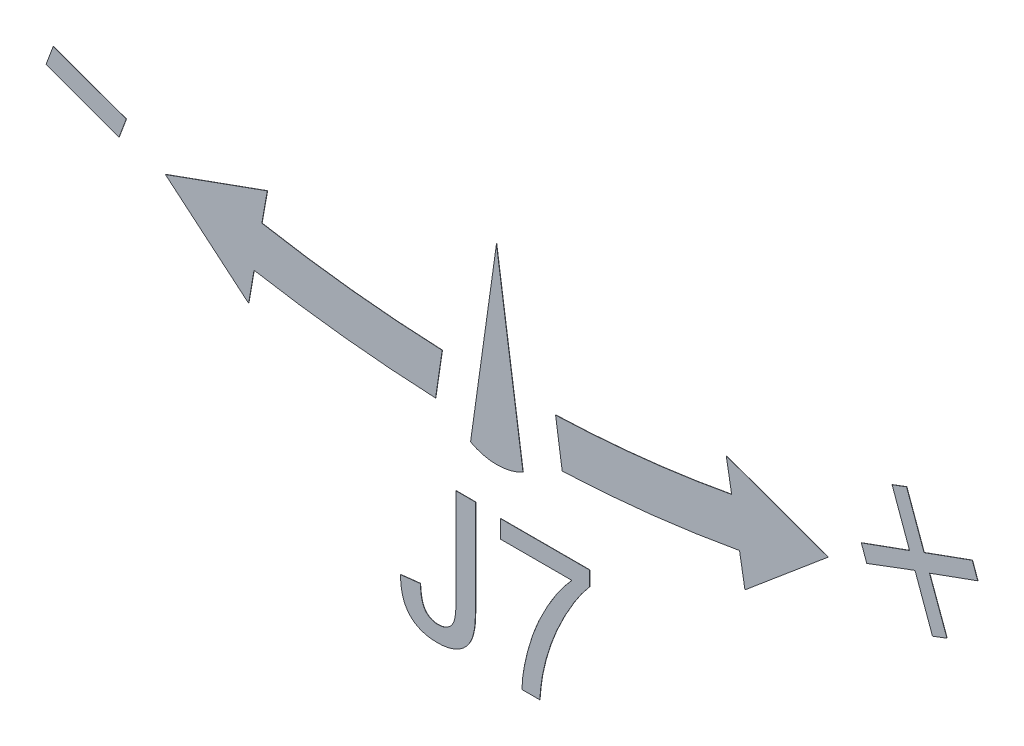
SolidWorks part; units mm, degrees
ref_plane "Front" through (0, 0, 0) normal (0, 0, 1) x (1, 0, 0)
ref_plane "Top" through (0, 0, 0) normal (0, 1, 0) x (1, 0, 0)
ref_plane "Right" through (0, 0, 0) normal (1, 0, 0) x (0, 0, -1)
sketch "Sketch1" plane through (0, 0, 0) normal (0, 0, 1) x (1, 0, 0)
  line L1616 (4481.7115, 1822.0394) -> (4481.7115, 1905.9102)
  line L1617 (4447.8406, 1780.6416) -> (4455.9051, 1781.1792)
  line L1618 (4455.9051, 1781.1792) -> (4464.5072, 1783.8674)
  line L1619 (4464.5072, 1783.8674) -> (4471.4964, 1788.7061)
  line L1620 (4471.4964, 1788.7061) -> (4476.8728, 1795.6953)
  line L1621 (4476.8728, 1795.6953) -> (4480.0986, 1803.7598)
  line L1622 (4480.0986, 1803.7598) -> (4481.1738, 1812.8996)
  line L1623 (4481.1738, 1812.8996) -> (4481.7115, 1822.0394)
  line L1624 (4415.0449, 1816.663) -> (4415.5826, 1809.1362)
  line L1625 (4415.5826, 1809.1362) -> (4416.6578, 1801.0717)
  line L1626 (4416.6578, 1801.0717) -> (4419.8836, 1794.0824)
  line L1627 (4419.8836, 1794.0824) -> (4424.7223, 1788.1685)
  line L1628 (4424.7223, 1788.1685) -> (4431.7116, 1783.8674)
  line L1629 (4431.7116, 1783.8674) -> (4439.2384, 1781.1792)
  line L1630 (4439.2384, 1781.1792) -> (4447.8406, 1780.6416)
  line L1631 (4432.2492, 1818.8136) -> (4415.0449, 1816.663)
  line L1632 (4448.3782, 1794.6201) -> (4444.0771, 1795.1577)
  line L1633 (4444.0771, 1795.1577) -> (4440.3137, 1796.7706)
  line L1634 (4440.3137, 1796.7706) -> (4437.6255, 1799.4588)
  line L1635 (4437.6255, 1799.4588) -> (4435.475, 1802.6846)
  line L1636 (4435.475, 1802.6846) -> (4433.3245, 1810.7491)
  line L1637 (4433.3245, 1810.7491) -> (4432.2492, 1818.8136)
  line L1638 (4463.9696, 1820.9641) -> (4463.9696, 1815.0501)
  line L1639 (4463.9696, 1815.0501) -> (4463.4319, 1809.1362)
  line L1640 (4463.4319, 1809.1362) -> (4462.3567, 1803.7598)
  line L1641 (4462.3567, 1803.7598) -> (4459.6685, 1799.9964)
  line L1642 (4459.6685, 1799.9964) -> (4456.4427, 1797.3082)
  line L1643 (4456.4427, 1797.3082) -> (4452.6793, 1795.1577)
  line L1644 (4452.6793, 1795.1577) -> (4448.3782, 1794.6201)
  line L1645 (4463.9696, 1905.9102) -> (4463.9696, 1820.9641)
  line L1646 (4481.7115, 1905.9102) -> (4463.9696, 1905.9102)
  line L1647 (4583.3242, 1891.3941) -> (4583.3242, 1904.2973)
  line L1648 (4544.0769, 1815.5878) -> (4552.1414, 1838.706)
  line L1649 (4552.1414, 1838.706) -> (4562.3565, 1860.2113)
  line L1650 (4562.3565, 1860.2113) -> (4572.0339, 1876.3403)
  line L1651 (4572.0339, 1876.3403) -> (4583.3242, 1891.3941)
  line L1652 (4538.7006, 1782.2545) -> (4540.8511, 1801.0717)
  line L1653 (4540.8511, 1801.0717) -> (4544.0769, 1815.5878)
  line L1654 (4523.1092, 1782.2545) -> (4538.7006, 1782.2545)
  line L1655 (4567.1952, 1888.7059) -> (4553.7543, 1870.964)
  line L1656 (4553.7543, 1870.964) -> (4543.0017, 1852.1468)
  line L1657 (4543.0017, 1852.1468) -> (4533.8619, 1832.2544)
  line L1658 (4533.8619, 1832.2544) -> (4528.4856, 1816.1254)
  line L1659 (4528.4856, 1816.1254) -> (4524.7221, 1799.4588)
  line L1660 (4524.7221, 1799.4588) -> (4523.1092, 1782.2545)
  line L1661 (4503.7544, 1888.7059) -> (4567.1952, 1888.7059)
  line L1662 (4503.7544, 1904.2973) -> (4503.7544, 1888.7059)
  line L1663 (4583.3242, 1904.2973) -> (4503.7544, 1904.2973)
  line L1664 (4098.3789, 2051.6088) -> (4163.4325, 2027.9529)
  line L1665 (4104.8305, 2068.8131) -> (4098.3789, 2051.6088)
  line L1666 (4169.8841, 2045.1572) -> (4104.8305, 2068.8131)
  line L1667 (4163.4325, 2027.9529) -> (4169.8841, 2045.1572)
  line L1668 (4852.6785, 2104.2969) -> (4868.2698, 2061.2862)
  line L1669 (4865.5817, 2109.1356) -> (4852.6785, 2104.2969)
  line L1670 (4881.173, 2066.1249) -> (4865.5817, 2109.1356)
  line L1671 (4924.1837, 2081.7163) -> (4881.173, 2066.1249)
  line L1672 (4929.0224, 2068.2754) -> (4924.1837, 2081.7163)
  line L1673 (4886.0117, 2052.6841) -> (4929.0224, 2068.2754)
  line L1674 (4901.6031, 2010.211) -> (4886.0117, 2052.6841)
  line L1675 (4888.6999, 2005.3723) -> (4901.6031, 2010.211)
  line L1676 (4873.1085, 2048.383) -> (4888.6999, 2005.3723)
  line L1677 (4830.0979, 2032.254) -> (4873.1085, 2048.383)
  line L1678 (4825.2592, 2045.6948) -> (4830.0979, 2032.254)
  line L1679 (4868.2698, 2061.2862) -> (4825.2592, 2045.6948)
  line L1680 (4476.8728, 1949.4585) -> (4477.4104, 1948.9208)
  line L1681 (4477.4104, 1948.9208) -> (4477.948, 1948.9208)
  line L1682 (4477.948, 1948.9208) -> (4478.4857, 1948.3832)
  line L1683 (4478.4857, 1948.3832) -> (4479.5609, 1948.3832)
  line L1684 (4479.5609, 1948.3832) -> (4480.0986, 1947.8456)
  line L1685 (4480.0986, 1947.8456) -> (4480.6362, 1947.8456)
  line L1686 (4480.6362, 1947.8456) -> (4481.1738, 1947.3079)
  line L1687 (4481.1738, 1947.3079) -> (4481.7115, 1947.3079)
  line L1688 (4481.7115, 1947.3079) -> (4482.7867, 1946.7703)
  line L1689 (4482.7867, 1946.7703) -> (4483.862, 1946.7703)
  line L1690 (4483.862, 1946.7703) -> (4484.3996, 1946.2327)
  line L1691 (4484.3996, 1946.2327) -> (4485.4749, 1946.2327)
  line L1692 (4485.4749, 1946.2327) -> (4486.0125, 1945.695)
  line L1693 (4486.0125, 1945.695) -> (4487.0878, 1945.695)
  line L1694 (4487.0878, 1945.695) -> (4487.6254, 1945.1574)
  line L1695 (4487.6254, 1945.1574) -> (4489.2383, 1945.1574)
  line L1696 (4489.2383, 1945.1574) -> (4489.776, 1944.6198)
  line L1697 (4489.776, 1944.6198) -> (4492.4641, 1944.6198)
  line L1698 (4492.4641, 1944.6198) -> (4493.0018, 1944.0821)
  line L1699 (4493.0018, 1944.0821) -> (4506.4426, 1944.0821)
  line L1700 (4506.4426, 1944.0821) -> (4506.9802, 1944.6198)
  line L1701 (4506.9802, 1944.6198) -> (4509.1308, 1944.6198)
  line L1702 (4509.1308, 1944.6198) -> (4510.206, 1945.1574)
  line L1703 (4510.206, 1945.1574) -> (4511.8189, 1945.1574)
  line L1704 (4511.8189, 1945.1574) -> (4512.3566, 1945.695)
  line L1705 (4512.3566, 1945.695) -> (4513.4318, 1945.695)
  line L1706 (4513.4318, 1945.695) -> (4513.9695, 1946.2327)
  line L1707 (4513.9695, 1946.2327) -> (4515.0447, 1946.2327)
  line L1708 (4515.0447, 1946.2327) -> (4515.5824, 1946.7703)
  line L1709 (4515.5824, 1946.7703) -> (4516.6576, 1946.7703)
  line L1710 (4516.6576, 1946.7703) -> (4517.1953, 1947.3079)
  line L1711 (4517.1953, 1947.3079) -> (4517.7329, 1947.3079)
  line L1712 (4517.7329, 1947.3079) -> (4518.2705, 1947.8456)
  line L1713 (4518.2705, 1947.8456) -> (4519.3458, 1947.8456)
  line L1714 (4519.3458, 1947.8456) -> (4519.8834, 1948.3832)
  line L1715 (4519.8834, 1948.3832) -> (4520.4211, 1948.3832)
  line L1716 (4520.4211, 1948.3832) -> (4520.9587, 1948.9208)
  line L1717 (4520.9587, 1948.9208) -> (4521.4963, 1948.9208)
  line L1718 (4521.4963, 1948.9208) -> (4522.034, 1949.4585)
  line L1719 (4522.034, 1949.4585) -> (4522.5716, 1949.4585)
  line L1720 (4522.5716, 1949.4585) -> (4523.1092, 1949.9961)
  line L1721 (4499.991, 2113.9743) -> (4476.8728, 1949.4585)
  line L1722 (4523.6469, 1949.4585) -> (4499.991, 2113.9743)
  line L1723 (4445.69, 1967.738) -> (4451.604, 2007.5229)
  line L1724 (4279.0237, 1957.523) -> (4283.8624, 1985.4799)
  line L1725 (4204.8303, 2019.8884) -> (4279.0237, 1957.523)
  line L1726 (4295.6903, 2052.6841) -> (4204.8303, 2019.8884)
  line L1727 (4290.8516, 2025.2648) -> (4295.6903, 2052.6841)
  line L1728 (4451.604, 2007.5229) -> (4436.5503, 2008.5981)
  line L1729 (4436.5503, 2008.5981) -> (4421.4965, 2009.1358)
  line L1730 (4421.4965, 2009.1358) -> (4406.9804, 2010.211)
  line L1731 (4406.9804, 2010.211) -> (4392.4643, 2011.8239)
  line L1732 (4392.4643, 2011.8239) -> (4377.4106, 2012.8992)
  line L1733 (4377.4106, 2012.8992) -> (4362.8945, 2014.5121)
  line L1734 (4362.8945, 2014.5121) -> (4347.8408, 2016.125)
  line L1735 (4347.8408, 2016.125) -> (4333.3247, 2018.2755)
  line L1736 (4333.3247, 2018.2755) -> (4318.8086, 2020.4261)
  line L1737 (4318.8086, 2020.4261) -> (4304.2925, 2022.5766)
  line L1738 (4304.2925, 2022.5766) -> (4290.314, 2025.2648)
  line L1739 (4283.8624, 1985.4799) -> (4298.9161, 1983.3294)
  line L1740 (4298.9161, 1983.3294) -> (4313.9699, 1980.6412)
  line L1741 (4313.9699, 1980.6412) -> (4329.0236, 1978.4907)
  line L1742 (4329.0236, 1978.4907) -> (4344.0773, 1976.8778)
  line L1743 (4344.0773, 1976.8778) -> (4359.1311, 1974.7272)
  line L1744 (4359.1311, 1974.7272) -> (4374.7224, 1973.1143)
  line L1745 (4374.7224, 1973.1143) -> (4389.7762, 1971.5014)
  line L1746 (4389.7762, 1971.5014) -> (4404.8299, 1970.4262)
  line L1747 (4404.8299, 1970.4262) -> (4420.4213, 1969.3509)
  line L1748 (4420.4213, 1969.3509) -> (4435.475, 1968.2756)
  line L1749 (4435.475, 1968.2756) -> (4445.69, 1968.2756)
  line L1750 (4704.8293, 2052.6841) -> (4709.668, 2025.2648)
  line L1751 (4552.6791, 2008.0605) -> (4558.593, 1967.738)
  line L1752 (4795.6893, 2019.8884) -> (4704.8293, 2052.6841)
  line L1753 (4709.668, 2025.2648) -> (4694.6143, 2023.1142)
  line L1754 (4694.6143, 2023.1142) -> (4680.0982, 2020.9637)
  line L1755 (4680.0982, 2020.9637) -> (4665.5821, 2018.8132)
  line L1756 (4665.5821, 2018.8132) -> (4651.066, 2016.6626)
  line L1757 (4651.066, 2016.6626) -> (4636.0122, 2015.0497)
  line L1758 (4636.0122, 2015.0497) -> (4621.4961, 2013.4368)
  line L1759 (4621.4961, 2013.4368) -> (4606.4424, 2011.8239)
  line L1760 (4606.4424, 2011.8239) -> (4591.9263, 2010.7487)
  line L1761 (4591.9263, 2010.7487) -> (4577.4102, 2009.6734)
  line L1762 (4577.4102, 2009.6734) -> (4562.3565, 2008.5981)
  line L1763 (4562.3565, 2008.5981) -> (4552.6791, 2008.0605)
  line L1764 (4716.6572, 1985.4799) -> (4721.4959, 1957.523)
  line L1765 (4558.593, 1967.738) -> (4573.6468, 1968.8133)
  line L1766 (4573.6468, 1968.8133) -> (4588.7005, 1969.8885)
  line L1767 (4588.7005, 1969.8885) -> (4604.2919, 1970.9638)
  line L1768 (4604.2919, 1970.9638) -> (4619.3456, 1972.5767)
  line L1769 (4619.3456, 1972.5767) -> (4634.3993, 1974.1896)
  line L1770 (4634.3993, 1974.1896) -> (4649.9907, 1975.8025)
  line L1771 (4649.9907, 1975.8025) -> (4665.0444, 1977.4154)
  line L1772 (4665.0444, 1977.4154) -> (4680.0982, 1979.5659)
  line L1773 (4680.0982, 1979.5659) -> (4695.1519, 1982.2541)
  line L1774 (4695.1519, 1982.2541) -> (4710.2056, 1984.4046)
  line L1775 (4710.2056, 1984.4046) -> (4716.6572, 1985.4799)
  line L1776 (4721.4959, 1957.523) -> (4795.6893, 2019.8884)
  line L7984 (4481.7115, 1822.0394) -> (4481.7115, 1905.9102)
  line L7985 (4481.7115, 1905.9102) -> (4463.9696, 1905.9102)
  line L7986 (4463.9696, 1905.9102) -> (4463.9696, 1811.2867)
  line L7987 (4463.9696, 1811.2867) -> (4463.4319, 1809.6738)
  line L7988 (4463.4319, 1809.6738) -> (4463.4319, 1807.5233)
  line L7989 (4463.4319, 1807.5233) -> (4462.8943, 1805.9104)
  line L7990 (4462.8943, 1805.9104) -> (4462.3567, 1804.8351)
  line L7991 (4462.3567, 1804.8351) -> (4462.3567, 1803.7598)
  line L7992 (4462.3567, 1803.7598) -> (4461.819, 1802.6846)
  line L7993 (4461.819, 1802.6846) -> (4461.2814, 1801.6093)
  line L7994 (4461.2814, 1801.6093) -> (4460.7438, 1801.0717)
  line L7995 (4460.7438, 1801.0717) -> (4459.6685, 1799.9964)
  line L7996 (4459.6685, 1799.9964) -> (4459.1309, 1798.9211)
  line L7997 (4459.1309, 1798.9211) -> (4458.5932, 1798.3835)
  line L7998 (4458.5932, 1798.3835) -> (4457.518, 1797.8459)
  line L7999 (4457.518, 1797.8459) -> (4456.4427, 1797.3082)
  line L8000 (4456.4427, 1797.3082) -> (4455.3674, 1796.7706)
  line L8001 (4455.3674, 1796.7706) -> (4454.2922, 1796.233)
  line L8002 (4454.2922, 1796.233) -> (4453.2169, 1795.6953)
  line L8003 (4453.2169, 1795.6953) -> (4452.1416, 1795.1577)
  line L8004 (4452.1416, 1795.1577) -> (4449.4535, 1795.1577)
  line L8005 (4449.4535, 1795.1577) -> (4448.3782, 1794.6201)
  line L8006 (4448.3782, 1794.6201) -> (4447.3029, 1795.1577)
  line L8007 (4447.3029, 1795.1577) -> (4444.6148, 1795.1577)
  line L8008 (4444.6148, 1795.1577) -> (4443.5395, 1795.6953)
  line L8009 (4443.5395, 1795.6953) -> (4442.4642, 1795.6953)
  line L8010 (4442.4642, 1795.6953) -> (4441.389, 1796.233)
  line L8011 (4441.389, 1796.233) -> (4440.3137, 1796.7706)
  line L8012 (4440.3137, 1796.7706) -> (4439.7761, 1797.3082)
  line L8013 (4439.7761, 1797.3082) -> (4438.7008, 1798.3835)
  line L8014 (4438.7008, 1798.3835) -> (4437.6255, 1798.9211)
  line L8015 (4437.6255, 1798.9211) -> (4437.0879, 1799.9964)
  line L8016 (4437.0879, 1799.9964) -> (4436.5503, 1801.0717)
  line L8017 (4436.5503, 1801.0717) -> (4436.0126, 1801.6093)
  line L8018 (4436.0126, 1801.6093) -> (4435.475, 1802.6846)
  line L8019 (4435.475, 1802.6846) -> (4434.9374, 1804.2975)
  line L8020 (4434.9374, 1804.2975) -> (4434.3997, 1805.9104)
  line L8021 (4434.3997, 1805.9104) -> (4433.8621, 1806.9856)
  line L8022 (4433.8621, 1806.9856) -> (4433.3245, 1808.5985)
  line L8023 (4433.3245, 1808.5985) -> (4433.3245, 1810.2114)
  line L8024 (4433.3245, 1810.2114) -> (4432.7868, 1811.8243)
  line L8025 (4432.7868, 1811.8243) -> (4432.7868, 1816.1254)
  line L8026 (4432.7868, 1816.1254) -> (4432.2492, 1818.8136)
  line L8027 (4432.2492, 1818.8136) -> (4415.0449, 1816.663)
  line L8028 (4415.0449, 1816.663) -> (4415.0449, 1809.1362)
  line L8029 (4415.0449, 1809.1362) -> (4415.5826, 1806.9856)
  line L8030 (4415.5826, 1806.9856) -> (4416.1202, 1804.2975)
  line L8031 (4416.1202, 1804.2975) -> (4416.6578, 1801.6093)
  line L8032 (4416.6578, 1801.6093) -> (4417.1955, 1799.4588)
  line L8033 (4417.1955, 1799.4588) -> (4418.2707, 1797.8459)
  line L8034 (4418.2707, 1797.8459) -> (4418.8084, 1795.6953)
  line L8035 (4418.8084, 1795.6953) -> (4419.8836, 1794.0824)
  line L8036 (4419.8836, 1794.0824) -> (4420.9589, 1792.4695)
  line L8037 (4420.9589, 1792.4695) -> (4422.0342, 1790.8566)
  line L8038 (4422.0342, 1790.8566) -> (4423.1094, 1789.2437)
  line L8039 (4423.1094, 1789.2437) -> (4424.7223, 1788.1685)
  line L8040 (4424.7223, 1788.1685) -> (4426.3352, 1786.5556)
  line L8041 (4426.3352, 1786.5556) -> (4427.9481, 1785.4803)
  line L8042 (4427.9481, 1785.4803) -> (4429.561, 1784.405)
  line L8043 (4429.561, 1784.405) -> (4431.1739, 1783.8674)
  line L8044 (4431.1739, 1783.8674) -> (4433.3245, 1782.7921)
  line L8045 (4433.3245, 1782.7921) -> (4434.9374, 1782.2545)
  line L8046 (4434.9374, 1782.2545) -> (4437.0879, 1781.7169)
  line L8047 (4437.0879, 1781.7169) -> (4439.2384, 1781.1792)
  line L8048 (4439.2384, 1781.1792) -> (4441.389, 1781.1792)
  line L8049 (4441.389, 1781.1792) -> (4443.5395, 1780.6416)
  line L8050 (4443.5395, 1780.6416) -> (4452.1416, 1780.6416)
  line L8051 (4452.1416, 1780.6416) -> (4454.2922, 1781.1792)
  line L8052 (4454.2922, 1781.1792) -> (4456.4427, 1781.1792)
  line L8053 (4456.4427, 1781.1792) -> (4458.0556, 1781.7169)
  line L8054 (4458.0556, 1781.7169) -> (4460.2061, 1782.2545)
  line L8055 (4460.2061, 1782.2545) -> (4462.3567, 1783.3298)
  line L8056 (4462.3567, 1783.3298) -> (4464.5072, 1783.8674)
  line L8057 (4464.5072, 1783.8674) -> (4466.1201, 1784.9427)
  line L8058 (4466.1201, 1784.9427) -> (4468.2706, 1786.0179)
  line L8059 (4468.2706, 1786.0179) -> (4469.8835, 1787.0932)
  line L8060 (4469.8835, 1787.0932) -> (4471.4964, 1788.7061)
  line L8061 (4471.4964, 1788.7061) -> (4473.1093, 1790.319)
  line L8062 (4473.1093, 1790.319) -> (4474.1846, 1791.9319)
  line L8063 (4474.1846, 1791.9319) -> (4475.7975, 1793.5448)
  line L8064 (4475.7975, 1793.5448) -> (4476.8728, 1795.6953)
  line L8065 (4476.8728, 1795.6953) -> (4477.948, 1797.3082)
  line L8066 (4477.948, 1797.3082) -> (4478.4857, 1799.4588)
  line L8067 (4478.4857, 1799.4588) -> (4479.0233, 1801.6093)
  line L8068 (4479.0233, 1801.6093) -> (4480.0986, 1803.7598)
  line L8069 (4480.0986, 1803.7598) -> (4480.0986, 1805.9104)
  line L8070 (4480.0986, 1805.9104) -> (4480.6362, 1808.0609)
  line L8071 (4480.6362, 1808.0609) -> (4481.1738, 1810.2114)
  line L8072 (4481.1738, 1810.2114) -> (4481.1738, 1812.8996)
  line L8073 (4481.1738, 1812.8996) -> (4481.7115, 1816.1254)
  line L8074 (4481.7115, 1816.1254) -> (4481.7115, 1822.0394)
  line L8075 (4481.7115, 1822.0394) -> (4481.7115, 1905.9102)
  line L8076 (4481.7115, 1905.9102) -> (4463.9696, 1905.9102)
  line L8077 (4463.9696, 1905.9102) -> (4463.9696, 1811.2867)
  line L8078 (4463.9696, 1811.2867) -> (4463.4319, 1809.6738)
  line L8079 (4463.4319, 1809.6738) -> (4463.4319, 1807.5233)
  line L8080 (4463.4319, 1807.5233) -> (4462.8943, 1805.9104)
  line L8081 (4462.8943, 1805.9104) -> (4462.3567, 1804.8351)
  line L8082 (4462.3567, 1804.8351) -> (4462.3567, 1803.7598)
  line L8083 (4462.3567, 1803.7598) -> (4461.819, 1802.6846)
  line L8084 (4461.819, 1802.6846) -> (4461.2814, 1801.6093)
  line L8085 (4461.2814, 1801.6093) -> (4460.7438, 1801.0717)
  line L8086 (4460.7438, 1801.0717) -> (4459.6685, 1799.9964)
  line L8087 (4459.6685, 1799.9964) -> (4459.1309, 1798.9211)
  line L8088 (4459.1309, 1798.9211) -> (4458.5932, 1798.3835)
  line L8089 (4458.5932, 1798.3835) -> (4457.518, 1797.8459)
  line L8090 (4457.518, 1797.8459) -> (4456.4427, 1797.3082)
  line L8091 (4456.4427, 1797.3082) -> (4455.3674, 1796.7706)
  line L8092 (4455.3674, 1796.7706) -> (4454.2922, 1796.233)
  line L8093 (4454.2922, 1796.233) -> (4453.2169, 1795.6953)
  line L8094 (4453.2169, 1795.6953) -> (4452.1416, 1795.1577)
  line L8095 (4452.1416, 1795.1577) -> (4449.4535, 1795.1577)
  line L8096 (4449.4535, 1795.1577) -> (4448.3782, 1794.6201)
  line L8097 (4448.3782, 1794.6201) -> (4447.3029, 1795.1577)
  line L8098 (4447.3029, 1795.1577) -> (4444.6148, 1795.1577)
  line L8099 (4444.6148, 1795.1577) -> (4443.5395, 1795.6953)
  line L8100 (4443.5395, 1795.6953) -> (4442.4642, 1795.6953)
  line L8101 (4442.4642, 1795.6953) -> (4441.389, 1796.233)
  line L8102 (4441.389, 1796.233) -> (4440.3137, 1796.7706)
  line L8103 (4440.3137, 1796.7706) -> (4439.7761, 1797.3082)
  line L8104 (4439.7761, 1797.3082) -> (4438.7008, 1798.3835)
  line L8105 (4438.7008, 1798.3835) -> (4437.6255, 1798.9211)
  line L8106 (4437.6255, 1798.9211) -> (4437.0879, 1799.9964)
  line L8107 (4437.0879, 1799.9964) -> (4436.5503, 1801.0717)
  line L8108 (4436.5503, 1801.0717) -> (4436.0126, 1801.6093)
  line L8109 (4436.0126, 1801.6093) -> (4435.475, 1802.6846)
  line L8110 (4435.475, 1802.6846) -> (4434.9374, 1804.2975)
  line L8111 (4434.9374, 1804.2975) -> (4434.3997, 1805.9104)
  line L8112 (4434.3997, 1805.9104) -> (4433.8621, 1806.9856)
  line L8113 (4433.8621, 1806.9856) -> (4433.3245, 1808.5985)
  line L8114 (4433.3245, 1808.5985) -> (4433.3245, 1810.2114)
  line L8115 (4433.3245, 1810.2114) -> (4432.7868, 1811.8243)
  line L8116 (4432.7868, 1811.8243) -> (4432.7868, 1816.1254)
  line L8117 (4432.7868, 1816.1254) -> (4432.2492, 1818.8136)
  line L8118 (4432.2492, 1818.8136) -> (4415.0449, 1816.663)
  line L8119 (4415.0449, 1816.663) -> (4415.0449, 1809.1362)
  line L8120 (4415.0449, 1809.1362) -> (4415.5826, 1806.9856)
  line L8121 (4415.5826, 1806.9856) -> (4416.1202, 1804.2975)
  line L8122 (4416.1202, 1804.2975) -> (4416.6578, 1801.6093)
  line L8123 (4416.6578, 1801.6093) -> (4417.1955, 1799.4588)
  line L8124 (4417.1955, 1799.4588) -> (4418.2707, 1797.8459)
  line L8125 (4418.2707, 1797.8459) -> (4418.8084, 1795.6953)
  line L8126 (4418.8084, 1795.6953) -> (4419.8836, 1794.0824)
  line L8127 (4419.8836, 1794.0824) -> (4420.9589, 1792.4695)
  line L8128 (4420.9589, 1792.4695) -> (4422.0342, 1790.8566)
  line L8129 (4422.0342, 1790.8566) -> (4423.1094, 1789.2437)
  line L8130 (4423.1094, 1789.2437) -> (4424.7223, 1788.1685)
  line L8131 (4424.7223, 1788.1685) -> (4426.3352, 1786.5556)
  line L8132 (4426.3352, 1786.5556) -> (4427.9481, 1785.4803)
  line L8133 (4427.9481, 1785.4803) -> (4429.561, 1784.405)
  line L8134 (4429.561, 1784.405) -> (4431.1739, 1783.8674)
  line L8135 (4431.1739, 1783.8674) -> (4433.3245, 1782.7921)
  line L8136 (4433.3245, 1782.7921) -> (4434.9374, 1782.2545)
  line L8137 (4434.9374, 1782.2545) -> (4437.0879, 1781.7169)
  line L8138 (4437.0879, 1781.7169) -> (4439.2384, 1781.1792)
  line L8139 (4439.2384, 1781.1792) -> (4441.389, 1781.1792)
  line L8140 (4441.389, 1781.1792) -> (4443.5395, 1780.6416)
  line L8141 (4443.5395, 1780.6416) -> (4452.1416, 1780.6416)
  line L8142 (4452.1416, 1780.6416) -> (4454.2922, 1781.1792)
  line L8143 (4454.2922, 1781.1792) -> (4456.4427, 1781.1792)
  line L8144 (4456.4427, 1781.1792) -> (4458.0556, 1781.7169)
  line L8145 (4458.0556, 1781.7169) -> (4460.2061, 1782.2545)
  line L8146 (4460.2061, 1782.2545) -> (4462.3567, 1783.3298)
  line L8147 (4462.3567, 1783.3298) -> (4464.5072, 1783.8674)
  line L8148 (4464.5072, 1783.8674) -> (4466.1201, 1784.9427)
  line L8149 (4466.1201, 1784.9427) -> (4468.2706, 1786.0179)
  line L8150 (4468.2706, 1786.0179) -> (4469.8835, 1787.0932)
  line L8151 (4469.8835, 1787.0932) -> (4471.4964, 1788.7061)
  line L8152 (4471.4964, 1788.7061) -> (4473.1093, 1790.319)
  line L8153 (4473.1093, 1790.319) -> (4474.1846, 1791.9319)
  line L8154 (4474.1846, 1791.9319) -> (4475.7975, 1793.5448)
  line L8155 (4475.7975, 1793.5448) -> (4476.8728, 1795.6953)
  line L8156 (4476.8728, 1795.6953) -> (4477.948, 1797.3082)
  line L8157 (4477.948, 1797.3082) -> (4478.4857, 1799.4588)
  line L8158 (4478.4857, 1799.4588) -> (4479.0233, 1801.6093)
  line L8159 (4479.0233, 1801.6093) -> (4480.0986, 1803.7598)
  line L8160 (4480.0986, 1803.7598) -> (4480.0986, 1805.9104)
  line L8161 (4480.0986, 1805.9104) -> (4480.6362, 1808.0609)
  line L8162 (4480.6362, 1808.0609) -> (4481.1738, 1810.2114)
  line L8163 (4481.1738, 1810.2114) -> (4481.1738, 1812.8996)
  line L8164 (4481.1738, 1812.8996) -> (4481.7115, 1816.1254)
  line L8165 (4481.7115, 1816.1254) -> (4481.7115, 1822.0394)
  line L8166 (4583.3242, 1891.3941) -> (4583.3242, 1904.2973)
  line L8167 (4583.3242, 1904.2973) -> (4503.7544, 1904.2973)
  line L8168 (4503.7544, 1904.2973) -> (4503.7544, 1888.7059)
  line L8169 (4503.7544, 1888.7059) -> (4567.1952, 1888.7059)
  line L8170 (4567.1952, 1888.7059) -> (4562.3565, 1882.7919)
  line L8171 (4562.3565, 1882.7919) -> (4558.0554, 1876.878)
  line L8172 (4558.0554, 1876.878) -> (4553.7543, 1870.964)
  line L8173 (4553.7543, 1870.964) -> (4549.9909, 1865.05)
  line L8174 (4549.9909, 1865.05) -> (4546.2275, 1858.5984)
  line L8175 (4546.2275, 1858.5984) -> (4542.464, 1852.1468)
  line L8176 (4542.464, 1852.1468) -> (4539.2382, 1845.6952)
  line L8177 (4539.2382, 1845.6952) -> (4536.5501, 1839.2436)
  line L8178 (4536.5501, 1839.2436) -> (4533.8619, 1832.2544)
  line L8179 (4533.8619, 1832.2544) -> (4531.7114, 1826.3404)
  line L8180 (4531.7114, 1826.3404) -> (4529.5608, 1820.4265)
  line L8181 (4529.5608, 1820.4265) -> (4527.9479, 1813.9749)
  line L8182 (4527.9479, 1813.9749) -> (4526.335, 1807.5233)
  line L8183 (4526.335, 1807.5233) -> (4525.2598, 1801.6093)
  line L8184 (4525.2598, 1801.6093) -> (4524.1845, 1795.1577)
  line L8185 (4524.1845, 1795.1577) -> (4523.1092, 1788.7061)
  line L8186 (4523.1092, 1788.7061) -> (4523.1092, 1782.2545)
  line L8187 (4523.1092, 1782.2545) -> (4538.7006, 1782.2545)
  line L8188 (4538.7006, 1782.2545) -> (4539.2382, 1786.0179)
  line L8189 (4539.2382, 1786.0179) -> (4539.2382, 1789.7814)
  line L8190 (4539.2382, 1789.7814) -> (4539.7759, 1793.5448)
  line L8191 (4539.7759, 1793.5448) -> (4540.3135, 1797.3082)
  line L8192 (4540.3135, 1797.3082) -> (4540.8511, 1801.0717)
  line L8193 (4540.8511, 1801.0717) -> (4541.9264, 1804.8351)
  line L8194 (4541.9264, 1804.8351) -> (4542.464, 1808.5985)
  line L8195 (4542.464, 1808.5985) -> (4543.5393, 1812.362)
  line L8196 (4543.5393, 1812.362) -> (4544.0769, 1815.5878)
  line L8197 (4544.0769, 1815.5878) -> (4546.2275, 1822.577)
  line L8198 (4546.2275, 1822.577) -> (4548.378, 1829.0286)
  line L8199 (4548.378, 1829.0286) -> (4550.5285, 1835.4802)
  line L8200 (4550.5285, 1835.4802) -> (4553.2167, 1841.9318)
  line L8201 (4553.2167, 1841.9318) -> (4555.9049, 1847.8458)
  line L8202 (4555.9049, 1847.8458) -> (4559.1307, 1854.2974)
  line L8203 (4559.1307, 1854.2974) -> (4562.3565, 1860.2113)
  line L8204 (4562.3565, 1860.2113) -> (4565.5823, 1865.5877)
  line L8205 (4565.5823, 1865.5877) -> (4568.2704, 1870.964)
  line L8206 (4568.2704, 1870.964) -> (4572.0339, 1876.3403)
  line L8207 (4572.0339, 1876.3403) -> (4575.2597, 1881.7167)
  line L8208 (4575.2597, 1881.7167) -> (4579.0231, 1886.5554)
  line L8209 (4579.0231, 1886.5554) -> (4583.3242, 1891.3941)
  line L8210 (4583.3242, 1891.3941) -> (4583.3242, 1904.2973)
  line L8211 (4583.3242, 1904.2973) -> (4503.7544, 1904.2973)
  line L8212 (4503.7544, 1904.2973) -> (4503.7544, 1888.7059)
  line L8213 (4503.7544, 1888.7059) -> (4567.1952, 1888.7059)
  line L8214 (4567.1952, 1888.7059) -> (4562.3565, 1882.7919)
  line L8215 (4562.3565, 1882.7919) -> (4558.0554, 1876.878)
  line L8216 (4558.0554, 1876.878) -> (4553.7543, 1870.964)
  line L8217 (4553.7543, 1870.964) -> (4549.9909, 1865.05)
  line L8218 (4549.9909, 1865.05) -> (4546.2275, 1858.5984)
  line L8219 (4546.2275, 1858.5984) -> (4542.464, 1852.1468)
  line L8220 (4542.464, 1852.1468) -> (4539.2382, 1845.6952)
  line L8221 (4539.2382, 1845.6952) -> (4536.5501, 1839.2436)
  line L8222 (4536.5501, 1839.2436) -> (4533.8619, 1832.2544)
  line L8223 (4533.8619, 1832.2544) -> (4531.7114, 1826.3404)
  line L8224 (4531.7114, 1826.3404) -> (4529.5608, 1820.4265)
  line L8225 (4529.5608, 1820.4265) -> (4527.9479, 1813.9749)
  line L8226 (4527.9479, 1813.9749) -> (4526.335, 1807.5233)
  line L8227 (4526.335, 1807.5233) -> (4525.2598, 1801.6093)
  line L8228 (4525.2598, 1801.6093) -> (4524.1845, 1795.1577)
  line L8229 (4524.1845, 1795.1577) -> (4523.1092, 1788.7061)
  line L8230 (4523.1092, 1788.7061) -> (4523.1092, 1782.2545)
  line L8231 (4523.1092, 1782.2545) -> (4538.7006, 1782.2545)
  line L8232 (4538.7006, 1782.2545) -> (4539.2382, 1786.0179)
  line L8233 (4539.2382, 1786.0179) -> (4539.2382, 1789.7814)
  line L8234 (4539.2382, 1789.7814) -> (4539.7759, 1793.5448)
  line L8235 (4539.7759, 1793.5448) -> (4540.3135, 1797.3082)
  line L8236 (4540.3135, 1797.3082) -> (4540.8511, 1801.0717)
  line L8237 (4540.8511, 1801.0717) -> (4541.9264, 1804.8351)
  line L8238 (4541.9264, 1804.8351) -> (4542.464, 1808.5985)
  line L8239 (4542.464, 1808.5985) -> (4543.5393, 1812.362)
  line L8240 (4543.5393, 1812.362) -> (4544.0769, 1815.5878)
  line L8241 (4544.0769, 1815.5878) -> (4546.2275, 1822.577)
  line L8242 (4546.2275, 1822.577) -> (4548.378, 1829.0286)
  line L8243 (4548.378, 1829.0286) -> (4550.5285, 1835.4802)
  line L8244 (4550.5285, 1835.4802) -> (4553.2167, 1841.9318)
  line L8245 (4553.2167, 1841.9318) -> (4555.9049, 1847.8458)
  line L8246 (4555.9049, 1847.8458) -> (4559.1307, 1854.2974)
  line L8247 (4559.1307, 1854.2974) -> (4562.3565, 1860.2113)
  line L8248 (4562.3565, 1860.2113) -> (4565.5823, 1865.5877)
  line L8249 (4565.5823, 1865.5877) -> (4568.2704, 1870.964)
  line L8250 (4568.2704, 1870.964) -> (4572.0339, 1876.3403)
  line L8251 (4572.0339, 1876.3403) -> (4575.2597, 1881.7167)
  line L8252 (4575.2597, 1881.7167) -> (4579.0231, 1886.5554)
  line L8253 (4579.0231, 1886.5554) -> (4583.3242, 1891.3941)
  line L8254 (4852.6785, 2104.2969) -> (4868.2698, 2061.2862)
  line L8255 (4868.2698, 2061.2862) -> (4825.2592, 2045.6948)
  line L8256 (4825.2592, 2045.6948) -> (4830.0979, 2032.254)
  line L8257 (4830.0979, 2032.254) -> (4873.1085, 2048.383)
  line L8258 (4873.1085, 2048.383) -> (4888.6999, 2005.3723)
  line L8259 (4888.6999, 2005.3723) -> (4901.6031, 2010.211)
  line L8260 (4901.6031, 2010.211) -> (4886.0117, 2052.6841)
  line L8261 (4886.0117, 2052.6841) -> (4929.0224, 2068.2754)
  line L8262 (4929.0224, 2068.2754) -> (4924.1837, 2081.7163)
  line L8263 (4924.1837, 2081.7163) -> (4881.173, 2066.1249)
  line L8264 (4881.173, 2066.1249) -> (4865.5817, 2109.1356)
  line L8265 (4865.5817, 2109.1356) -> (4852.6785, 2104.2969)
  line L8266 (4852.6785, 2104.2969) -> (4868.2698, 2061.2862)
  line L8267 (4868.2698, 2061.2862) -> (4825.2592, 2045.6948)
  line L8268 (4825.2592, 2045.6948) -> (4830.0979, 2032.254)
  line L8269 (4830.0979, 2032.254) -> (4873.1085, 2048.383)
  line L8270 (4873.1085, 2048.383) -> (4888.6999, 2005.3723)
  line L8271 (4888.6999, 2005.3723) -> (4901.6031, 2010.211)
  line L8272 (4901.6031, 2010.211) -> (4886.0117, 2052.6841)
  line L8273 (4886.0117, 2052.6841) -> (4929.0224, 2068.2754)
  line L8274 (4929.0224, 2068.2754) -> (4924.1837, 2081.7163)
  line L8275 (4924.1837, 2081.7163) -> (4881.173, 2066.1249)
  line L8276 (4881.173, 2066.1249) -> (4865.5817, 2109.1356)
  line L8277 (4865.5817, 2109.1356) -> (4852.6785, 2104.2969)
  line L8278 (4098.3789, 2051.6088) -> (4163.4325, 2027.9529)
  line L8279 (4163.4325, 2027.9529) -> (4169.8841, 2045.1572)
  line L8280 (4169.8841, 2045.1572) -> (4104.8305, 2068.8131)
  line L8281 (4104.8305, 2068.8131) -> (4098.3789, 2051.6088)
  line L8282 (4098.3789, 2051.6088) -> (4163.4325, 2027.9529)
  line L8283 (4163.4325, 2027.9529) -> (4169.8841, 2045.1572)
  line L8284 (4169.8841, 2045.1572) -> (4104.8305, 2068.8131)
  line L8285 (4104.8305, 2068.8131) -> (4098.3789, 2051.6088)
  line L8286 (4445.69, 1967.738) -> (4451.604, 2007.5229)
  line L8287 (4451.604, 2007.5229) -> (4436.5503, 2008.5981)
  line L8288 (4436.5503, 2008.5981) -> (4422.0342, 2009.1358)
  line L8289 (4422.0342, 2009.1358) -> (4407.5181, 2010.211)
  line L8290 (4407.5181, 2010.211) -> (4393.002, 2011.2863)
  line L8291 (4393.002, 2011.2863) -> (4377.9482, 2012.8992)
  line L8292 (4377.9482, 2012.8992) -> (4363.4321, 2014.5121)
  line L8293 (4363.4321, 2014.5121) -> (4348.916, 2016.125)
  line L8294 (4348.916, 2016.125) -> (4334.3999, 2018.2755)
  line L8295 (4334.3999, 2018.2755) -> (4319.8838, 2020.4261)
  line L8296 (4319.8838, 2020.4261) -> (4305.3677, 2022.5766)
  line L8297 (4305.3677, 2022.5766) -> (4290.8516, 2025.2648)
  line L8298 (4290.8516, 2025.2648) -> (4295.6903, 2052.6841)
  line L8299 (4295.6903, 2052.6841) -> (4204.8303, 2019.8884)
  line L8300 (4204.8303, 2019.8884) -> (4279.0237, 1957.523)
  line L8301 (4279.0237, 1957.523) -> (4283.8624, 1985.4799)
  line L8302 (4283.8624, 1985.4799) -> (4298.3785, 1982.7917)
  line L8303 (4298.3785, 1982.7917) -> (4312.8946, 1980.6412)
  line L8304 (4312.8946, 1980.6412) -> (4327.4107, 1978.4907)
  line L8305 (4327.4107, 1978.4907) -> (4342.4644, 1976.3401)
  line L8306 (4342.4644, 1976.3401) -> (4356.9805, 1974.7272)
  line L8307 (4356.9805, 1974.7272) -> (4372.0343, 1973.1143)
  line L8308 (4372.0343, 1973.1143) -> (4386.5504, 1971.5014)
  line L8309 (4386.5504, 1971.5014) -> (4401.6041, 1970.4262)
  line L8310 (4401.6041, 1970.4262) -> (4416.1202, 1969.3509)
  line L8311 (4416.1202, 1969.3509) -> (4431.1739, 1968.2756)
  line L8312 (4431.1739, 1968.2756) -> (4445.69, 1967.738)
  line L8313 (4445.69, 1967.738) -> (4451.604, 2007.5229)
  line L8314 (4451.604, 2007.5229) -> (4436.5503, 2008.5981)
  line L8315 (4436.5503, 2008.5981) -> (4422.0342, 2009.1358)
  line L8316 (4422.0342, 2009.1358) -> (4407.5181, 2010.211)
  line L8317 (4407.5181, 2010.211) -> (4393.002, 2011.2863)
  line L8318 (4393.002, 2011.2863) -> (4377.9482, 2012.8992)
  line L8319 (4377.9482, 2012.8992) -> (4363.4321, 2014.5121)
  line L8320 (4363.4321, 2014.5121) -> (4348.916, 2016.125)
  line L8321 (4348.916, 2016.125) -> (4334.3999, 2018.2755)
  line L8322 (4334.3999, 2018.2755) -> (4319.8838, 2020.4261)
  line L8323 (4319.8838, 2020.4261) -> (4305.3677, 2022.5766)
  line L8324 (4305.3677, 2022.5766) -> (4290.8516, 2025.2648)
  line L8325 (4290.8516, 2025.2648) -> (4295.6903, 2052.6841)
  line L8326 (4295.6903, 2052.6841) -> (4204.8303, 2019.8884)
  line L8327 (4204.8303, 2019.8884) -> (4279.0237, 1957.523)
  line L8328 (4279.0237, 1957.523) -> (4283.8624, 1985.4799)
  line L8329 (4283.8624, 1985.4799) -> (4298.3785, 1982.7917)
  line L8330 (4298.3785, 1982.7917) -> (4312.8946, 1980.6412)
  line L8331 (4312.8946, 1980.6412) -> (4327.4107, 1978.4907)
  line L8332 (4327.4107, 1978.4907) -> (4342.4644, 1976.3401)
  line L8333 (4342.4644, 1976.3401) -> (4356.9805, 1974.7272)
  line L8334 (4356.9805, 1974.7272) -> (4372.0343, 1973.1143)
  line L8335 (4372.0343, 1973.1143) -> (4386.5504, 1971.5014)
  line L8336 (4386.5504, 1971.5014) -> (4401.6041, 1970.4262)
  line L8337 (4401.6041, 1970.4262) -> (4416.1202, 1969.3509)
  line L8338 (4416.1202, 1969.3509) -> (4431.1739, 1968.2756)
  line L8339 (4431.1739, 1968.2756) -> (4445.69, 1967.738)
  line L8340 (4552.6791, 2008.0605) -> (4558.593, 1967.738)
  line L8341 (4558.593, 1967.738) -> (4573.1091, 1968.2756)
  line L8342 (4573.1091, 1968.2756) -> (4587.6252, 1969.3509)
  line L8343 (4587.6252, 1969.3509) -> (4601.6037, 1970.4262)
  line L8344 (4601.6037, 1970.4262) -> (4616.1198, 1972.0391)
  line L8345 (4616.1198, 1972.0391) -> (4630.6359, 1973.1143)
  line L8346 (4630.6359, 1973.1143) -> (4645.152, 1974.7272)
  line L8347 (4645.152, 1974.7272) -> (4659.6681, 1976.3401)
  line L8348 (4659.6681, 1976.3401) -> (4673.6466, 1978.4907)
  line L8349 (4673.6466, 1978.4907) -> (4688.1627, 1980.6412)
  line L8350 (4688.1627, 1980.6412) -> (4702.6788, 1982.7917)
  line L8351 (4702.6788, 1982.7917) -> (4716.6572, 1985.4799)
  line L8352 (4716.6572, 1985.4799) -> (4721.4959, 1957.523)
  line L8353 (4721.4959, 1957.523) -> (4795.6893, 2019.8884)
  line L8354 (4795.6893, 2019.8884) -> (4704.8293, 2052.6841)
  line L8355 (4704.8293, 2052.6841) -> (4709.668, 2025.2648)
  line L8356 (4709.668, 2025.2648) -> (4695.6895, 2022.5766)
  line L8357 (4695.6895, 2022.5766) -> (4681.1734, 2020.4261)
  line L8358 (4681.1734, 2020.4261) -> (4667.195, 2018.2755)
  line L8359 (4667.195, 2018.2755) -> (4653.2165, 2016.6626)
  line L8360 (4653.2165, 2016.6626) -> (4638.7004, 2014.5121)
  line L8361 (4638.7004, 2014.5121) -> (4624.1843, 2012.8992)
  line L8362 (4624.1843, 2012.8992) -> (4610.2058, 2011.8239)
  line L8363 (4610.2058, 2011.8239) -> (4595.6897, 2010.7487)
  line L8364 (4595.6897, 2010.7487) -> (4581.7113, 2009.6734)
  line L8365 (4581.7113, 2009.6734) -> (4567.1952, 2008.5981)
  line L8366 (4567.1952, 2008.5981) -> (4552.6791, 2008.0605)
  line L8367 (4552.6791, 2008.0605) -> (4558.593, 1967.738)
  line L8368 (4558.593, 1967.738) -> (4573.1091, 1968.2756)
  line L8369 (4573.1091, 1968.2756) -> (4587.6252, 1969.3509)
  line L8370 (4587.6252, 1969.3509) -> (4601.6037, 1970.4262)
  line L8371 (4601.6037, 1970.4262) -> (4616.1198, 1972.0391)
  line L8372 (4616.1198, 1972.0391) -> (4630.6359, 1973.1143)
  line L8373 (4630.6359, 1973.1143) -> (4645.152, 1974.7272)
  line L8374 (4645.152, 1974.7272) -> (4659.6681, 1976.3401)
  line L8375 (4659.6681, 1976.3401) -> (4673.6466, 1978.4907)
  line L8376 (4673.6466, 1978.4907) -> (4688.1627, 1980.6412)
  line L8377 (4688.1627, 1980.6412) -> (4702.6788, 1982.7917)
  line L8378 (4702.6788, 1982.7917) -> (4716.6572, 1985.4799)
  line L8379 (4716.6572, 1985.4799) -> (4721.4959, 1957.523)
  line L8380 (4721.4959, 1957.523) -> (4795.6893, 2019.8884)
  line L8381 (4795.6893, 2019.8884) -> (4704.8293, 2052.6841)
  line L8382 (4704.8293, 2052.6841) -> (4709.668, 2025.2648)
  line L8383 (4709.668, 2025.2648) -> (4695.6895, 2022.5766)
  line L8384 (4695.6895, 2022.5766) -> (4681.1734, 2020.4261)
  line L8385 (4681.1734, 2020.4261) -> (4667.195, 2018.2755)
  line L8386 (4667.195, 2018.2755) -> (4653.2165, 2016.6626)
  line L8387 (4653.2165, 2016.6626) -> (4638.7004, 2014.5121)
  line L8388 (4638.7004, 2014.5121) -> (4624.1843, 2012.8992)
  line L8389 (4624.1843, 2012.8992) -> (4610.2058, 2011.8239)
  line L8390 (4610.2058, 2011.8239) -> (4595.6897, 2010.7487)
  line L8391 (4595.6897, 2010.7487) -> (4581.7113, 2009.6734)
  line L8392 (4581.7113, 2009.6734) -> (4567.1952, 2008.5981)
  line L8393 (4567.1952, 2008.5981) -> (4552.6791, 2008.0605)
  line L8394 (4476.8728, 1949.4585) -> (4478.4857, 1948.3832)
  line L8395 (4478.4857, 1948.3832) -> (4479.5609, 1947.8456)
  line L8396 (4479.5609, 1947.8456) -> (4481.1738, 1947.3079)
  line L8397 (4481.1738, 1947.3079) -> (4482.2491, 1946.7703)
  line L8398 (4482.2491, 1946.7703) -> (4483.862, 1946.2327)
  line L8399 (4483.862, 1946.2327) -> (4485.4749, 1945.695)
  line L8400 (4485.4749, 1945.695) -> (4486.5502, 1945.1574)
  line L8401 (4486.5502, 1945.1574) -> (4488.1631, 1944.6198)
  line L8402 (4488.1631, 1944.6198) -> (4489.776, 1944.6198)
  line L8403 (4489.776, 1944.6198) -> (4491.3889, 1944.0821)
  line L8404 (4491.3889, 1944.0821) -> (4492.4641, 1944.0821)
  line L8405 (4492.4641, 1944.0821) -> (4494.077, 1943.5445)
  line L8406 (4494.077, 1943.5445) -> (4506.4426, 1943.5445)
  line L8407 (4506.4426, 1943.5445) -> (4507.5179, 1944.0821)
  line L8408 (4507.5179, 1944.0821) -> (4509.1308, 1944.0821)
  line L8409 (4509.1308, 1944.0821) -> (4510.7437, 1944.6198)
  line L8410 (4510.7437, 1944.6198) -> (4512.3566, 1944.6198)
  line L8411 (4512.3566, 1944.6198) -> (4513.4318, 1945.1574)
  line L8412 (4513.4318, 1945.1574) -> (4515.0447, 1945.695)
  line L8413 (4515.0447, 1945.695) -> (4516.6576, 1946.2327)
  line L8414 (4516.6576, 1946.2327) -> (4517.7329, 1946.7703)
  line L8415 (4517.7329, 1946.7703) -> (4519.3458, 1947.3079)
  line L8416 (4519.3458, 1947.3079) -> (4520.9587, 1947.8456)
  line L8417 (4520.9587, 1947.8456) -> (4522.034, 1948.3832)
  line L8418 (4522.034, 1948.3832) -> (4523.6469, 1949.4585)
  line L8419 (4523.6469, 1949.4585) -> (4499.991, 2113.9743)
  line L8420 (4499.991, 2113.9743) -> (4476.8728, 1949.4585)
  line L8421 (4476.8728, 1949.4585) -> (4478.4857, 1948.3832)
  line L8422 (4478.4857, 1948.3832) -> (4479.5609, 1947.8456)
  line L8423 (4479.5609, 1947.8456) -> (4481.1738, 1947.3079)
  line L8424 (4481.1738, 1947.3079) -> (4482.2491, 1946.7703)
  line L8425 (4482.2491, 1946.7703) -> (4483.862, 1946.2327)
  line L8426 (4483.862, 1946.2327) -> (4485.4749, 1945.695)
  line L8427 (4485.4749, 1945.695) -> (4486.5502, 1945.1574)
  line L8428 (4486.5502, 1945.1574) -> (4488.1631, 1944.6198)
  line L8429 (4488.1631, 1944.6198) -> (4489.776, 1944.6198)
  line L8430 (4489.776, 1944.6198) -> (4491.3889, 1944.0821)
  line L8431 (4491.3889, 1944.0821) -> (4492.4641, 1944.0821)
  line L8432 (4492.4641, 1944.0821) -> (4494.077, 1943.5445)
  line L8433 (4494.077, 1943.5445) -> (4506.4426, 1943.5445)
  line L8434 (4506.4426, 1943.5445) -> (4507.5179, 1944.0821)
  line L8435 (4507.5179, 1944.0821) -> (4509.1308, 1944.0821)
  line L8436 (4509.1308, 1944.0821) -> (4510.7437, 1944.6198)
  line L8437 (4510.7437, 1944.6198) -> (4512.3566, 1944.6198)
  line L8438 (4512.3566, 1944.6198) -> (4513.4318, 1945.1574)
  line L8439 (4513.4318, 1945.1574) -> (4515.0447, 1945.695)
  line L8440 (4515.0447, 1945.695) -> (4516.6576, 1946.2327)
  line L8441 (4516.6576, 1946.2327) -> (4517.7329, 1946.7703)
  line L8442 (4517.7329, 1946.7703) -> (4519.3458, 1947.3079)
  line L8443 (4519.3458, 1947.3079) -> (4520.9587, 1947.8456)
  line L8444 (4520.9587, 1947.8456) -> (4522.034, 1948.3832)
  line L8445 (4522.034, 1948.3832) -> (4523.6469, 1949.4585)
  line L8446 (4523.6469, 1949.4585) -> (4499.991, 2113.9743)
  line L8447 (4499.991, 2113.9743) -> (4476.8728, 1949.4585)
sketch "Sketch3" plane through (0, 0, 0) normal (0, 0, 1) x (1, 0, 0)
  line L0 (4409.807, 1781.1893) -> (4633.7536, 1781.1893) construction
  text T0 "J7" font "Arial" height 124
sketch "Sketch2" plane through (0, 0, 0) normal (0, 0, 1) x (1, 0, 0)
  line L0 (4169.8841, 2045.1572) -> (4104.8305, 2068.8131) construction
  line L1 (4104.8305, 2068.8131) -> (4098.3789, 2051.6088) construction
  line L2 (4098.3789, 2051.6088) -> (4163.4325, 2027.9529) construction
  line L3 (4163.4325, 2027.9529) -> (4169.8841, 2045.1572) construction
  line L4 (4295.6903, 2052.6841) -> (4204.8303, 2019.8884) construction
  line L5 (4290.8516, 2025.2648) -> (4295.6903, 2052.6841) construction
  line L6 (4279.0237, 1957.523) -> (4283.8624, 1985.4799) construction
  line L7 (4204.8303, 2019.8884) -> (4279.0237, 1957.523) construction
  line L8 (4445.69, 1967.738) -> (4451.604, 2007.5229) construction
  line L9 (4499.991, 2113.9743) -> (4476.8728, 1949.4585) construction
  line L10 (4523.6469, 1949.4585) -> (4499.991, 2113.9743) construction
  line L11 (4552.6791, 2008.0605) -> (4558.593, 1967.738) construction
  line L12 (4704.8293, 2052.6841) -> (4709.668, 2025.2648) construction
  line L13 (4795.6893, 2019.8884) -> (4704.8293, 2052.6841) construction
  line L14 (4721.4959, 1957.523) -> (4795.6893, 2019.8884) construction
  line L15 (4716.6572, 1985.4799) -> (4721.4959, 1957.523) construction
  line L16 (4825.2592, 2045.6948) -> (4830.0979, 2032.254) construction
  line L17 (4868.2698, 2061.2862) -> (4825.2592, 2045.6948) construction
  line L18 (4830.0979, 2032.254) -> (4873.1085, 2048.383) construction
  line L19 (4873.1085, 2048.383) -> (4888.6999, 2005.3723) construction
  line L20 (4888.6999, 2005.3723) -> (4901.6031, 2010.211) construction
  line L21 (4901.6031, 2010.211) -> (4886.0117, 2052.6841) construction
  line L22 (4886.0117, 2052.6841) -> (4929.0224, 2068.2754) construction
  line L23 (4924.1837, 2081.7163) -> (4881.173, 2066.1249) construction
  line L24 (4929.0224, 2068.2754) -> (4924.1837, 2081.7163) construction
  line L25 (4881.173, 2066.1249) -> (4865.5817, 2109.1356) construction
  line L26 (4852.6785, 2104.2969) -> (4868.2698, 2061.2862) construction
  line L27 (4865.5817, 2109.1356) -> (4852.6785, 2104.2969) construction
  line L28 (4169.8841, 2045.1572) -> (4104.8305, 2068.8131)
  line L29 (4104.8305, 2068.8131) -> (4098.3789, 2051.6088)
  line L30 (4098.3789, 2051.6088) -> (4163.4325, 2027.9529)
  line L31 (4163.4325, 2027.9529) -> (4169.8841, 2045.1572)
  line L32 (4295.6903, 2052.6841) -> (4204.8303, 2019.8884)
  line L33 (4290.8516, 2025.2648) -> (4295.6903, 2052.6841)
  line L34 (4279.0237, 1957.523) -> (4283.8624, 1985.4799)
  line L35 (4204.8303, 2019.8884) -> (4279.0237, 1957.523)
  line L36 (4445.69, 1967.738) -> (4451.604, 2007.5229)
  line L37 (4499.991, 2113.9743) -> (4476.8728, 1949.4585)
  line L38 (4523.6469, 1949.4585) -> (4499.991, 2113.9743)
  line L39 (4552.6791, 2008.0605) -> (4558.593, 1967.738)
  line L40 (4704.8293, 2052.6841) -> (4709.668, 2025.2648)
  line L41 (4795.6893, 2019.8884) -> (4704.8293, 2052.6841)
  line L42 (4721.4959, 1957.523) -> (4795.6893, 2019.8884)
  line L43 (4716.6572, 1985.4799) -> (4721.4959, 1957.523)
  line L44 (4825.2592, 2045.6948) -> (4830.0979, 2032.254)
  line L45 (4868.2698, 2061.2862) -> (4825.2592, 2045.6948)
  line L46 (4830.0979, 2032.254) -> (4873.1085, 2048.383)
  line L47 (4873.1085, 2048.383) -> (4888.6999, 2005.3723)
  line L48 (4888.6999, 2005.3723) -> (4901.6031, 2010.211)
  line L49 (4901.6031, 2010.211) -> (4886.0117, 2052.6841)
  line L50 (4886.0117, 2052.6841) -> (4929.0224, 2068.2754)
  line L51 (4924.1837, 2081.7163) -> (4881.173, 2066.1249)
  line L52 (4929.0224, 2068.2754) -> (4924.1837, 2081.7163)
  line L53 (4881.173, 2066.1249) -> (4865.5817, 2109.1356)
  line L54 (4852.6785, 2104.2969) -> (4868.2698, 2061.2862)
  line L55 (4865.5817, 2109.1356) -> (4852.6785, 2104.2969)
  arc A0 (4290.8516, 2025.2648) -> (4451.604, 2007.5229) centre (4498.5524, 3170.0316) ccw
  arc A1 (4283.8624, 1985.4799) -> (4445.69, 1967.738) centre (4501.8061, 3226.4878) ccw
  arc A2 (4552.6791, 2008.0605) -> (4709.668, 2025.2648) centre (4516.8808, 3059.5841) ccw
  arc A3 (4558.593, 1967.738) -> (4716.6572, 1985.4799) centre (4508.6776, 3125.4142) ccw
  arc A4 (4476.8728, 1949.4585) -> (4523.6469, 1949.4585) centre (4500.2598, 1992.7441) ccw
  dimension "D1" = 1260
extrude "Boss-Extrude1" add sketch "Sketch3" along normal blind 0.25
extrude "Boss-Extrude2" add sketch "Sketch2" along normal up to surface (0.25 mm away) separate body
scale "Scale1" bodies to scale 111 110 109 108 107 106 105 scale about origin uniform scaling yes scale factor 0.040197
